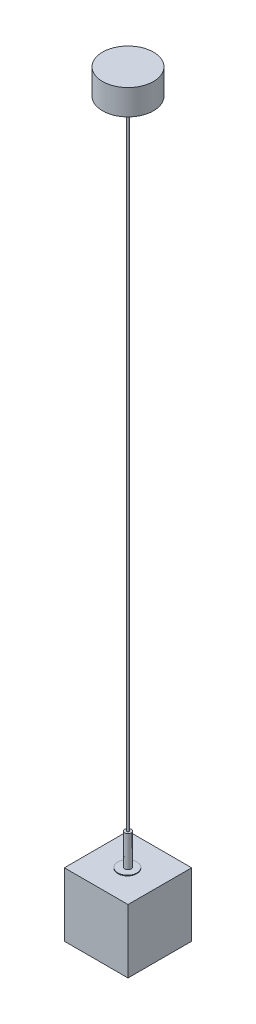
SolidWorks part; units mm, degrees
ref_plane "Alzado" through (0, 0, 0) normal (0, 0, 1) x (1, 0, 0)
ref_plane "Planta" through (0, 0, 0) normal (0, 1, 0) x (1, 0, 0)
ref_plane "Vista lateral" through (0, 0, 0) normal (1, 0, 0) x (0, 0, -1)
sketch "Croquis1" plane through (0, 0, 0) normal (0, 1, 0) x (1, 0, 0)
  line L1 (-50, 50) -> (50, 50)
  line L2 (-50, 50) -> (-50, -50)
  line L3 (-50, -50) -> (50, -50)
  line L4 (50, 50) -> (50, -50)
  line L5 (-50, 50) -> (50, -50) construction
  line L6 (-50, -50) -> (50, 50) construction
  point P0 (0, 0)
  dimension "D1" = 100
  dimension "D2" = 100
extrude "Saliente-Extruir1" add sketch "Croquis1" along normal blind 100
shell "Vaciado1" thickness 2
sketch "Croquis3" plane through (0, 100, 0) normal (0, 1, 0) x (1, 0, 0)
  circle A0 centre (0, 0) radius 5
  dimension "D1" = 10
extrude "Saliente-Extruir2" add sketch "Croquis3" along normal blind 50 separate body
sketch "Croquis4" plane through (0, 150, 0) normal (0, 1, 0) x (1, 0, 0)
  circle A0 centre (0, 0) radius 1.5
  dimension "D1" = 3
extrude "Saliente-Extruir3" add sketch "Croquis4" along normal blind 1000 separate body
sketch "Croquis5" plane through (0, 1150, 0) normal (0, 1, 0) x (1, 0, 0)
  circle A0 centre (0, 0) radius 40
  dimension "D1" = 80
extrude "Saliente-Extruir4" add sketch "Croquis5" along normal blind 40 separate body
sketch "Croquis6" plane through (0, 100, 0) normal (0, 1, 0) x (1, 0, 0)
  circle A0 centre (0, 0) radius 5
  circle A1 centre (0, -1.0175) radius 15
  dimension "D1" = 30
extrude "Saliente-Extruir5" add sketch "Croquis6" along normal blind 1 separate body
